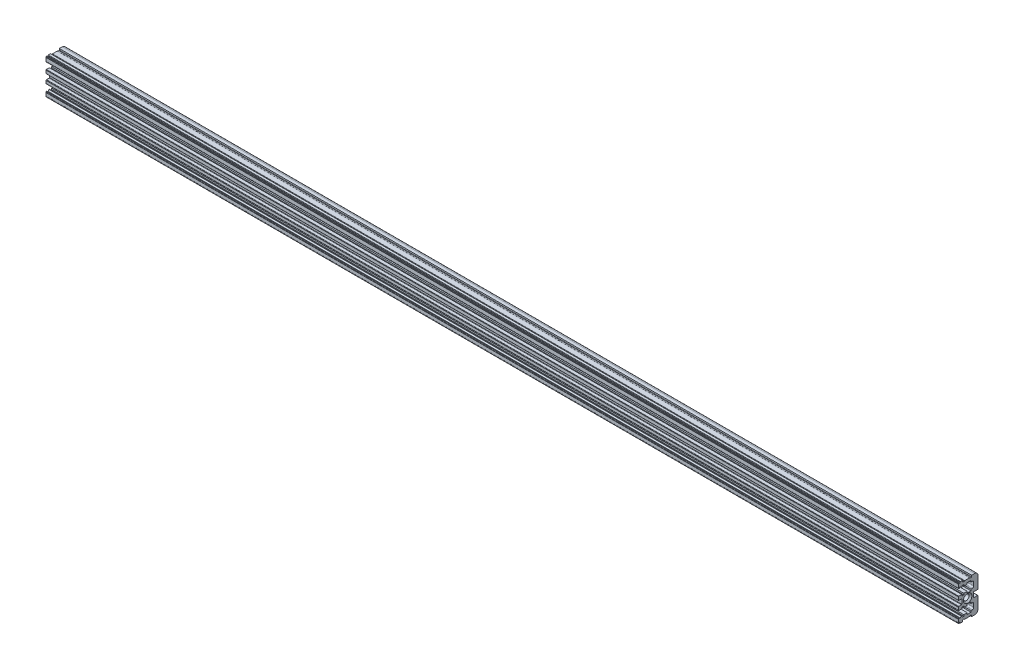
SolidWorks part; units mm, degrees
other "1"
ref_plane "前视基准面" through (0, 0, 0) normal (0, 0, 1) x (1, 0, 0)
ref_plane "上视基准面" through (0, 0, 0) normal (0, 1, 0) x (1, 0, 0)
ref_plane "右视基准面" through (0, 0, 0) normal (1, 0, 0) x (0, 0, -1)
imported_body "输入1"
sketch "草图1" plane through (-215.9, 0, 0) normal (-1, 0, 0) x (0, 0, 1)
  line L1 (4.751, 4.3263) -> (26.1747, 4.3263)
  line L2 (4.751, 4.3263) -> (4.751, -23.3079)
  line L3 (4.751, -23.3079) -> (26.1747, -23.3079)
  line L4 (26.1747, 4.3263) -> (26.1747, -23.3079)
extrude "切除-拉伸1" cut sketch "草图1" against normal blind 20
sketch "草图2" plane through (-195.9, 0, 0) normal (-1, 0, 0) x (0, 0, 1)
  line L92 (18.25, -11.2) -> (18.25, -8.6)
  line L93 (18.45, -8.4) -> (19.9942, -8.4)
  line L94 (20.2086, -8.2414) -> (20.25, -8.2)
  line L95 (20.25, -8.2) -> (20.25, -6.45)
  line L96 (20.25, -6.45) -> (20.2086, -6.4086)
  line L97 (19.9942, -6.25) -> (18.25, -6.25)
  line L98 (18.25, -6.25) -> (18.25, -7.1)
  line L99 (18.25, -7.1) -> (17.05, -7.1)
  line L100 (17.05, -7.1) -> (17.05, -6.25)
  line L101 (17.05, -6.25) -> (15.05, -6.25)
  line L102 (15.05, -6.25) -> (15.05, -7.1)
  line L103 (15.05, -7.1) -> (12.85, -7.1)
  line L104 (12.85, -7.1) -> (12.85, -6.25)
  line L105 (12.85, -6.25) -> (12.05, -6.25)
  line L106 (11.25, -5.45) -> (11.25, -3.5)
  line L107 (12.05, -2.7) -> (12.85, -2.7)
  line L108 (12.85, -2.7) -> (12.85, -1.85)
  line L109 (12.85, -1.85) -> (15.05, -1.85)
  line L110 (15.05, -1.85) -> (15.05, -2.7)
  line L111 (15.05, -2.7) -> (17.05, -2.7)
  line L112 (17.05, -2.7) -> (17.05, -1.85)
  line L113 (17.05, -1.85) -> (18.25, -1.85)
  line L114 (18.25, -1.85) -> (18.25, -2.7)
  line L115 (18.25, -2.7) -> (18.3672, -2.7)
  line L116 (18.5086, -2.6414) -> (19.0914, -2.0586)
  line L117 (19.2328, -2) -> (19.45, -2)
  line L118 (19.65, -2.2) -> (19.65, -2.3)
  line L119 (19.85, -2.5) -> (19.95, -2.5)
  line L120 (20.15, -2.3) -> (20.15, -2.2328)
  line L121 (20.2086, -2.0914) -> (20.25, -2.05)
  line L122 (20.25, -2.05) -> (20.25, -0.05)
  line L123 (20.25, -0.05) -> (20.2086, -0.0086)
  line L124 (20.15, 0.1328) -> (20.15, 0.2)
  line L125 (19.95, 0.4) -> (19.85, 0.4)
  line L126 (19.65, 0.2) -> (19.65, 0.1)
  line L127 (19.45, -0.1) -> (19.35, -0.1)
  line L128 (19.15, 0.1) -> (19.15, 0.4)
  line L129 (18.95, 0.6) -> (17.7, 0.6)
  line L130 (17.7, 0.6) -> (17.7, -0.2)
  line L131 (17.5, -0.4) -> (16.8873, -0.4)
  line L132 (16.5, -0.1) -> (13.7, -0.1)
  line L133 (13.3127, -0.4) -> (12.7, -0.4)
  line L134 (12.5, -0.2) -> (12.5, 0.6)
  line L135 (12.5, 0.6) -> (10.75, 0.6)
  line L136 (8.75, -1.4) -> (8.75, -8.2)
  line L137 (8.95, -8.4) -> (11.25, -8.4)
  line L138 (11.25, -8.4) -> (11.25, -11.4)
  line L139 (11.25, -11.4) -> (8.95, -11.4)
  line L140 (8.75, -11.6) -> (8.75, -18.4)
  line L141 (10.75, -20.4) -> (12.5, -20.4)
  line L142 (12.5, -20.4) -> (12.5, -19.6)
  line L143 (12.7, -19.4) -> (13.3127, -19.4)
  line L144 (13.7, -19.7) -> (16.5, -19.7)
  line L145 (16.8873, -19.4) -> (17.5, -19.4)
  line L146 (17.7, -19.6) -> (17.7, -20.4)
  line L147 (17.7, -20.4) -> (18.95, -20.4)
  line L148 (19.15, -20.2) -> (19.15, -19.9)
  line L149 (19.35, -19.7) -> (19.45, -19.7)
  line L150 (19.65, -19.9) -> (19.65, -20)
  line L151 (19.85, -20.2) -> (19.95, -20.2)
  line L152 (20.15, -20) -> (20.15, -19.8328)
  line L153 (20.2086, -19.6914) -> (20.25, -19.65)
  line L154 (20.25, -19.65) -> (20.25, -17.85)
  line L155 (20.25, -17.85) -> (20.2086, -17.8086)
  line L156 (20.15, -17.6672) -> (20.15, -17.5)
  line L157 (19.95, -17.3) -> (19.85, -17.3)
  line L158 (19.65, -17.5) -> (19.65, -17.6)
  line L159 (19.45, -17.8) -> (19.2328, -17.8)
  line L160 (19.0914, -17.7414) -> (18.5086, -17.1586)
  line L161 (18.3672, -17.1) -> (18.25, -17.1)
  line L162 (18.25, -17.1) -> (18.25, -17.95)
  line L163 (18.25, -17.95) -> (17.05, -17.95)
  line L164 (17.05, -17.95) -> (17.05, -17.1)
  line L165 (17.05, -17.1) -> (15.05, -17.1)
  line L166 (15.05, -17.1) -> (15.05, -17.95)
  line L167 (15.05, -17.95) -> (12.85, -17.95)
  line L168 (12.85, -17.95) -> (12.85, -17.1)
  line L169 (12.85, -17.1) -> (12.05, -17.1)
  line L170 (11.25, -16.3) -> (11.25, -14.35)
  line L171 (12.05, -13.55) -> (12.85, -13.55)
  line L172 (12.85, -13.55) -> (12.85, -12.7)
  line L173 (12.85, -12.7) -> (15.05, -12.7)
  line L174 (15.05, -12.7) -> (15.05, -13.55)
  line L175 (15.05, -13.55) -> (17.05, -13.55)
  line L176 (17.05, -13.55) -> (17.05, -12.7)
  line L177 (17.05, -12.7) -> (18.25, -12.7)
  line L178 (18.25, -12.7) -> (18.25, -13.55)
  line L179 (18.25, -13.55) -> (19.9587, -13.55)
  line L180 (20.2086, -13.2914) -> (20.25, -13.25)
  line L181 (20.25, -13.25) -> (20.25, -11.7)
  line L182 (20.25, -11.7) -> (20.2086, -11.6586)
  line L183 (19.9587, -11.4) -> (18.45, -11.4)
  line L184 (18.25, -11.2) -> (18.25, -8.6)
  line L185 (18.45, -8.4) -> (19.9942, -8.4)
  line L186 (20.2086, -8.2414) -> (20.25, -8.2)
  line L187 (20.25, -8.2) -> (20.25, -6.45)
  line L188 (20.25, -6.45) -> (20.2086, -6.4086)
  line L189 (19.9942, -6.25) -> (18.25, -6.25)
  line L190 (18.25, -6.25) -> (18.25, -7.1)
  line L191 (18.25, -7.1) -> (17.05, -7.1)
  line L192 (17.05, -7.1) -> (17.05, -6.25)
  line L193 (17.05, -6.25) -> (15.05, -6.25)
  line L194 (15.05, -6.25) -> (15.05, -7.1)
  line L195 (15.05, -7.1) -> (12.85, -7.1)
  line L196 (12.85, -7.1) -> (12.85, -6.25)
  line L197 (12.85, -6.25) -> (12.05, -6.25)
  line L198 (11.25, -5.45) -> (11.25, -3.5)
  line L199 (12.05, -2.7) -> (12.85, -2.7)
  line L200 (12.85, -2.7) -> (12.85, -1.85)
  line L201 (12.85, -1.85) -> (15.05, -1.85)
  line L202 (15.05, -1.85) -> (15.05, -2.7)
  line L203 (15.05, -2.7) -> (17.05, -2.7)
  line L204 (17.05, -2.7) -> (17.05, -1.85)
  line L205 (17.05, -1.85) -> (18.25, -1.85)
  line L206 (18.25, -1.85) -> (18.25, -2.7)
  line L207 (18.25, -2.7) -> (18.3672, -2.7)
  line L208 (18.5086, -2.6414) -> (19.0914, -2.0586)
  line L209 (19.2328, -2) -> (19.45, -2)
  line L210 (19.65, -2.2) -> (19.65, -2.3)
  line L211 (19.85, -2.5) -> (19.95, -2.5)
  line L212 (20.15, -2.3) -> (20.15, -2.2328)
  line L213 (20.2086, -2.0914) -> (20.25, -2.05)
  line L214 (20.25, -2.05) -> (20.25, -0.05)
  line L215 (20.25, -0.05) -> (20.2086, -0.0086)
  line L216 (20.15, 0.1328) -> (20.15, 0.2)
  line L217 (19.95, 0.4) -> (19.85, 0.4)
  line L218 (19.65, 0.2) -> (19.65, 0.1)
  line L219 (19.45, -0.1) -> (19.35, -0.1)
  line L220 (19.15, 0.1) -> (19.15, 0.4)
  line L221 (18.95, 0.6) -> (17.7, 0.6)
  line L222 (17.7, 0.6) -> (17.7, -0.2)
  line L223 (17.5, -0.4) -> (16.8873, -0.4)
  line L224 (16.5, -0.1) -> (13.7, -0.1)
  line L225 (13.3127, -0.4) -> (12.7, -0.4)
  line L226 (12.5, -0.2) -> (12.5, 0.6)
  line L227 (12.5, 0.6) -> (10.75, 0.6)
  line L228 (8.75, -1.4) -> (8.75, -8.2)
  line L229 (8.95, -8.4) -> (11.25, -8.4)
  line L230 (11.25, -8.4) -> (11.25, -11.4)
  line L231 (11.25, -11.4) -> (8.95, -11.4)
  line L232 (8.75, -11.6) -> (8.75, -18.4)
  line L233 (10.75, -20.4) -> (12.5, -20.4)
  line L234 (12.5, -20.4) -> (12.5, -19.6)
  line L235 (12.7, -19.4) -> (13.3127, -19.4)
  line L236 (13.7, -19.7) -> (16.5, -19.7)
  line L237 (16.8873, -19.4) -> (17.5, -19.4)
  line L238 (17.7, -19.6) -> (17.7, -20.4)
  line L239 (17.7, -20.4) -> (18.95, -20.4)
  line L240 (19.15, -20.2) -> (19.15, -19.9)
  line L241 (19.35, -19.7) -> (19.45, -19.7)
  line L242 (19.65, -19.9) -> (19.65, -20)
  line L243 (19.85, -20.2) -> (19.95, -20.2)
  line L244 (20.15, -20) -> (20.15, -19.8328)
  line L245 (20.2086, -19.6914) -> (20.25, -19.65)
  line L246 (20.25, -19.65) -> (20.25, -17.85)
  line L247 (20.25, -17.85) -> (20.2086, -17.8086)
  line L248 (20.15, -17.6672) -> (20.15, -17.5)
  line L249 (19.95, -17.3) -> (19.85, -17.3)
  line L250 (19.65, -17.5) -> (19.65, -17.6)
  line L251 (19.45, -17.8) -> (19.2328, -17.8)
  line L252 (19.0914, -17.7414) -> (18.5086, -17.1586)
  line L253 (18.3672, -17.1) -> (18.25, -17.1)
  line L254 (18.25, -17.1) -> (18.25, -17.95)
  line L255 (18.25, -17.95) -> (17.05, -17.95)
  line L256 (17.05, -17.95) -> (17.05, -17.1)
  line L257 (17.05, -17.1) -> (15.05, -17.1)
  line L258 (15.05, -17.1) -> (15.05, -17.95)
  line L259 (15.05, -17.95) -> (12.85, -17.95)
  line L260 (12.85, -17.95) -> (12.85, -17.1)
  line L261 (12.85, -17.1) -> (12.05, -17.1)
  line L262 (11.25, -16.3) -> (11.25, -14.35)
  line L263 (12.05, -13.55) -> (12.85, -13.55)
  line L264 (12.85, -13.55) -> (12.85, -12.7)
  line L265 (12.85, -12.7) -> (15.05, -12.7)
  line L266 (15.05, -12.7) -> (15.05, -13.55)
  line L267 (15.05, -13.55) -> (17.05, -13.55)
  line L268 (17.05, -13.55) -> (17.05, -12.7)
  line L269 (17.05, -12.7) -> (18.25, -12.7)
  line L270 (18.25, -12.7) -> (18.25, -13.55)
  line L271 (18.25, -13.55) -> (19.9587, -13.55)
  line L272 (20.2086, -13.2914) -> (20.25, -13.25)
  line L273 (20.25, -13.25) -> (20.25, -11.7)
  line L274 (20.25, -11.7) -> (20.2086, -11.6586)
  line L275 (19.9587, -11.4) -> (18.45, -11.4)
  circle A0 centre (14.8, -9.9) radius 1.25 construction
  circle A1 centre (14.8, -9.9) radius 1.25
  arc A54 (18.25, -11.2) -> (18.45, -11.4) centre (18.45, -11.2) ccw
  arc A55 (18.45, -8.4) -> (18.25, -8.6) centre (18.45, -8.6) ccw
  arc A56 (19.9942, -8.4) -> (20.1721, -8.2914) centre (19.9942, -8.2) ccw
  arc A57 (20.2086, -8.2414) -> (20.1721, -8.2914) centre (20.35, -8.3828) ccw
  arc A58 (20.1721, -6.3586) -> (20.2086, -6.4086) centre (20.35, -6.2672) ccw
  arc A59 (20.1721, -6.3586) -> (19.9942, -6.25) centre (19.9942, -6.45) ccw
  arc A60 (11.25, -5.45) -> (12.05, -6.25) centre (12.05, -5.45) ccw
  arc A61 (12.05, -2.7) -> (11.25, -3.5) centre (12.05, -3.5) ccw
  arc A62 (18.3672, -2.7) -> (18.5086, -2.6414) centre (18.3672, -2.5) ccw
  arc A63 (19.2328, -2) -> (19.0914, -2.0586) centre (19.2328, -2.2) ccw
  arc A64 (19.65, -2.2) -> (19.45, -2) centre (19.45, -2.2) ccw
  arc A65 (19.65, -2.3) -> (19.85, -2.5) centre (19.85, -2.3) ccw
  arc A66 (19.95, -2.5) -> (20.15, -2.3) centre (19.95, -2.3) ccw
  arc A67 (20.2086, -2.0914) -> (20.15, -2.2328) centre (20.35, -2.2328) ccw
  arc A68 (20.15, 0.1328) -> (20.2086, -0.0086) centre (20.35, 0.1328) ccw
  arc A69 (20.15, 0.2) -> (19.95, 0.4) centre (19.95, 0.2) ccw
  arc A70 (19.85, 0.4) -> (19.65, 0.2) centre (19.85, 0.2) ccw
  arc A71 (19.45, -0.1) -> (19.65, 0.1) centre (19.45, 0.1) ccw
  arc A72 (19.15, 0.1) -> (19.35, -0.1) centre (19.35, 0.1) ccw
  arc A73 (19.15, 0.4) -> (18.95, 0.6) centre (18.95, 0.4) ccw
  arc A74 (17.5, -0.4) -> (17.7, -0.2) centre (17.5, -0.2) ccw
  arc A75 (16.6936, -0.25) -> (16.8873, -0.4) centre (16.8873, -0.2) ccw
  arc A76 (16.6936, -0.25) -> (16.5, -0.1) centre (16.5, -0.3) ccw
  arc A77 (13.7, -0.1) -> (13.5064, -0.25) centre (13.7, -0.3) ccw
  arc A78 (13.3127, -0.4) -> (13.5064, -0.25) centre (13.3127, -0.2) ccw
  arc A79 (12.5, -0.2) -> (12.7, -0.4) centre (12.7, -0.2) ccw
  arc A80 (10.75, 0.6) -> (8.75, -1.4) centre (10.75, -1.4) ccw
  arc A81 (8.75, -8.2) -> (8.95, -8.4) centre (8.95, -8.2) ccw
  arc A82 (8.95, -11.4) -> (8.75, -11.6) centre (8.95, -11.6) ccw
  arc A83 (8.75, -18.4) -> (10.75, -20.4) centre (10.75, -18.4) ccw
  arc A84 (12.7, -19.4) -> (12.5, -19.6) centre (12.7, -19.6) ccw
  arc A85 (13.5064, -19.55) -> (13.3127, -19.4) centre (13.3127, -19.6) ccw
  arc A86 (13.5064, -19.55) -> (13.7, -19.7) centre (13.7, -19.5) ccw
  arc A87 (16.5, -19.7) -> (16.6936, -19.55) centre (16.5, -19.5) ccw
  arc A88 (16.8873, -19.4) -> (16.6936, -19.55) centre (16.8873, -19.6) ccw
  arc A89 (17.7, -19.6) -> (17.5, -19.4) centre (17.5, -19.6) ccw
  arc A90 (18.95, -20.4) -> (19.15, -20.2) centre (18.95, -20.2) ccw
  arc A91 (19.35, -19.7) -> (19.15, -19.9) centre (19.35, -19.9) ccw
  arc A92 (19.65, -19.9) -> (19.45, -19.7) centre (19.45, -19.9) ccw
  arc A93 (19.65, -20) -> (19.85, -20.2) centre (19.85, -20) ccw
  arc A94 (19.95, -20.2) -> (20.15, -20) centre (19.95, -20) ccw
  arc A95 (20.2086, -19.6914) -> (20.15, -19.8328) centre (20.35, -19.8328) ccw
  arc A96 (20.15, -17.6672) -> (20.2086, -17.8086) centre (20.35, -17.6672) ccw
  arc A97 (20.15, -17.5) -> (19.95, -17.3) centre (19.95, -17.5) ccw
  arc A98 (19.85, -17.3) -> (19.65, -17.5) centre (19.85, -17.5) ccw
  arc A99 (19.45, -17.8) -> (19.65, -17.6) centre (19.45, -17.6) ccw
  arc A100 (19.0914, -17.7414) -> (19.2328, -17.8) centre (19.2328, -17.6) ccw
  arc A101 (18.5086, -17.1586) -> (18.3672, -17.1) centre (18.3672, -17.3) ccw
  arc A102 (11.25, -16.3) -> (12.05, -17.1) centre (12.05, -16.3) ccw
  arc A103 (12.05, -13.55) -> (11.25, -14.35) centre (12.05, -14.35) ccw
  arc A104 (19.9587, -13.55) -> (20.1543, -13.3914) centre (19.9587, -13.35) ccw
  arc A105 (20.2086, -13.2914) -> (20.1543, -13.3914) centre (20.35, -13.4328) ccw
  arc A106 (20.1543, -11.5586) -> (20.2086, -11.6586) centre (20.35, -11.5172) ccw
  arc A107 (20.1543, -11.5586) -> (19.9587, -11.4) centre (19.9587, -11.6) ccw
  arc A108 (18.25, -11.2) -> (18.45, -11.4) centre (18.45, -11.2) ccw
  arc A109 (18.45, -8.4) -> (18.25, -8.6) centre (18.45, -8.6) ccw
  arc A110 (19.9942, -8.4) -> (20.1721, -8.2914) centre (19.9942, -8.2) ccw
  arc A111 (20.2086, -8.2414) -> (20.1721, -8.2914) centre (20.35, -8.3828) ccw
  arc A112 (20.1721, -6.3586) -> (20.2086, -6.4086) centre (20.35, -6.2672) ccw
  arc A113 (20.1721, -6.3586) -> (19.9942, -6.25) centre (19.9942, -6.45) ccw
  arc A114 (11.25, -5.45) -> (12.05, -6.25) centre (12.05, -5.45) ccw
  arc A115 (12.05, -2.7) -> (11.25, -3.5) centre (12.05, -3.5) ccw
  arc A116 (18.3672, -2.7) -> (18.5086, -2.6414) centre (18.3672, -2.5) ccw
  arc A117 (19.2328, -2) -> (19.0914, -2.0586) centre (19.2328, -2.2) ccw
  arc A118 (19.65, -2.2) -> (19.45, -2) centre (19.45, -2.2) ccw
  arc A119 (19.65, -2.3) -> (19.85, -2.5) centre (19.85, -2.3) ccw
  arc A120 (19.95, -2.5) -> (20.15, -2.3) centre (19.95, -2.3) ccw
  arc A121 (20.2086, -2.0914) -> (20.15, -2.2328) centre (20.35, -2.2328) ccw
  arc A122 (20.15, 0.1328) -> (20.2086, -0.0086) centre (20.35, 0.1328) ccw
  arc A123 (20.15, 0.2) -> (19.95, 0.4) centre (19.95, 0.2) ccw
  arc A124 (19.85, 0.4) -> (19.65, 0.2) centre (19.85, 0.2) ccw
  arc A125 (19.45, -0.1) -> (19.65, 0.1) centre (19.45, 0.1) ccw
  arc A126 (19.15, 0.1) -> (19.35, -0.1) centre (19.35, 0.1) ccw
  arc A127 (19.15, 0.4) -> (18.95, 0.6) centre (18.95, 0.4) ccw
  arc A128 (17.5, -0.4) -> (17.7, -0.2) centre (17.5, -0.2) ccw
  arc A129 (16.6936, -0.25) -> (16.8873, -0.4) centre (16.8873, -0.2) ccw
  arc A130 (16.6936, -0.25) -> (16.5, -0.1) centre (16.5, -0.3) ccw
  arc A131 (13.7, -0.1) -> (13.5064, -0.25) centre (13.7, -0.3) ccw
  arc A132 (13.3127, -0.4) -> (13.5064, -0.25) centre (13.3127, -0.2) ccw
  arc A133 (12.5, -0.2) -> (12.7, -0.4) centre (12.7, -0.2) ccw
  arc A134 (10.75, 0.6) -> (8.75, -1.4) centre (10.75, -1.4) ccw
  arc A135 (8.75, -8.2) -> (8.95, -8.4) centre (8.95, -8.2) ccw
  arc A136 (8.95, -11.4) -> (8.75, -11.6) centre (8.95, -11.6) ccw
  arc A137 (8.75, -18.4) -> (10.75, -20.4) centre (10.75, -18.4) ccw
  arc A138 (12.7, -19.4) -> (12.5, -19.6) centre (12.7, -19.6) ccw
  arc A139 (13.5064, -19.55) -> (13.3127, -19.4) centre (13.3127, -19.6) ccw
  arc A140 (13.5064, -19.55) -> (13.7, -19.7) centre (13.7, -19.5) ccw
  arc A141 (16.5, -19.7) -> (16.6936, -19.55) centre (16.5, -19.5) ccw
  arc A142 (16.8873, -19.4) -> (16.6936, -19.55) centre (16.8873, -19.6) ccw
  arc A143 (17.7, -19.6) -> (17.5, -19.4) centre (17.5, -19.6) ccw
  arc A144 (18.95, -20.4) -> (19.15, -20.2) centre (18.95, -20.2) ccw
  arc A145 (19.35, -19.7) -> (19.15, -19.9) centre (19.35, -19.9) ccw
  arc A146 (19.65, -19.9) -> (19.45, -19.7) centre (19.45, -19.9) ccw
  arc A147 (19.65, -20) -> (19.85, -20.2) centre (19.85, -20) ccw
  arc A148 (19.95, -20.2) -> (20.15, -20) centre (19.95, -20) ccw
  arc A149 (20.2086, -19.6914) -> (20.15, -19.8328) centre (20.35, -19.8328) ccw
  arc A150 (20.15, -17.6672) -> (20.2086, -17.8086) centre (20.35, -17.6672) ccw
  arc A151 (20.15, -17.5) -> (19.95, -17.3) centre (19.95, -17.5) ccw
  arc A152 (19.85, -17.3) -> (19.65, -17.5) centre (19.85, -17.5) ccw
  arc A153 (19.45, -17.8) -> (19.65, -17.6) centre (19.45, -17.6) ccw
  arc A154 (19.0914, -17.7414) -> (19.2328, -17.8) centre (19.2328, -17.6) ccw
  arc A155 (18.5086, -17.1586) -> (18.3672, -17.1) centre (18.3672, -17.3) ccw
  arc A156 (11.25, -16.3) -> (12.05, -17.1) centre (12.05, -16.3) ccw
  arc A157 (12.05, -13.55) -> (11.25, -14.35) centre (12.05, -14.35) ccw
  arc A158 (19.9587, -13.55) -> (20.1543, -13.3914) centre (19.9587, -13.35) ccw
  arc A159 (20.2086, -13.2914) -> (20.1543, -13.3914) centre (20.35, -13.4328) ccw
  arc A160 (20.1543, -11.5586) -> (20.2086, -11.6586) centre (20.35, -11.5172) ccw
  arc A161 (20.1543, -11.5586) -> (19.9587, -11.4) centre (19.9587, -11.6) ccw
  dimension "D1" = 0
extrude "凸台-拉伸1" add sketch "草图2" along normal blind 121.6
sketch "草图3" plane through (-317.5, 0, 0) normal (-1, 0, 0) x (0, 0, 1)
  circle A0 centre (14.8, -9.9) radius 1.65
  dimension "D1" = 3.3
extrude "切除-拉伸2" cut sketch "草图3" against normal blind 15.02
chamfer "倒角1" distance 0.85 angle 45 1 edges at (-317.5, -9.9, 16.45)
